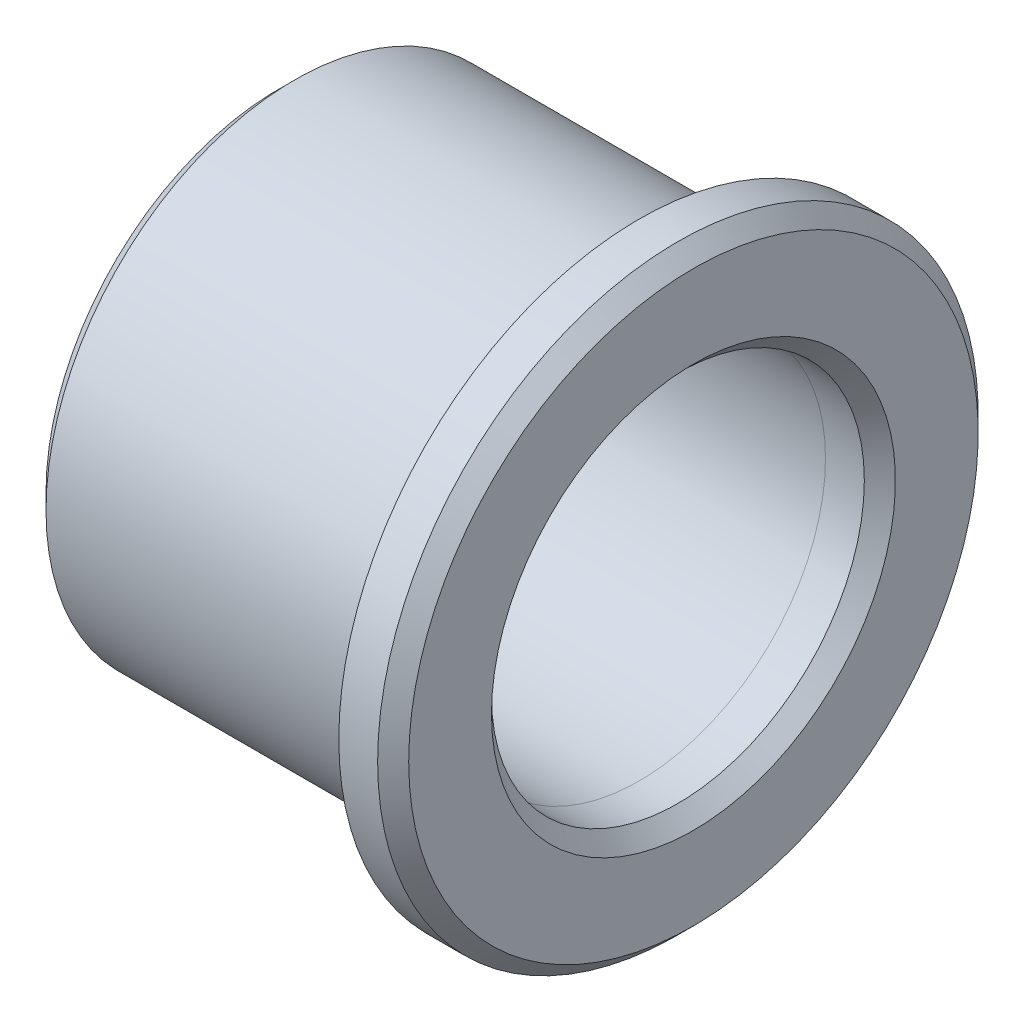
SolidWorks part; units mm, degrees
ref_plane "Plan de face" through (0, 0, 0) normal (0, 0, 1) x (1, 0, 0)
ref_plane "Plan de dessus" through (0, 0, 0) normal (0, 1, 0) x (1, 0, 0)
ref_plane "Plan de droite" through (0, 0, 0) normal (1, 0, 0) x (0, 0, -1)
sketch "Esquisse2" plane through (0, 0, -154.8499) normal (0, 0, 1) x (1, 0, 0)
  line L1 (30.3271, -158.8236) -> (53.5, -158.8236)
  line L2 (30.3271, -158.8236) -> (30.3271, -154.824)
  line L3 (30.3271, -154.824) -> (53.0762, -154.824)
  line L4 (16.8957, -170.824) -> (53.5, -170.824) construction
  line L5 (53.5, -151.4961) -> (57, -151.4961)
  line L6 (53.5, -151.4961) -> (53.5, -154.4002)
  line L7 (53.5, -158.824) -> (57, -158.824)
  line L8 (57, -151.4961) -> (57, -158.824)
  line L9 (53.5, -158.8236) -> (53.5, -158.824)
  arc A0 (53.0762, -154.824) -> (53.5, -154.4002) centre (53.3396, -154.6636) ccw
revolve "Révolution1" add sketch "Esquisse2" angle 360 about L4
chamfer "Chanfrein1" distance 1 angle 45 4 edges at (57, -170.824, -135.5221) (30.3271, -170.824, -142.8495) (57, -170.824, -142.8499) (30.3271, -170.824, -138.8499)
